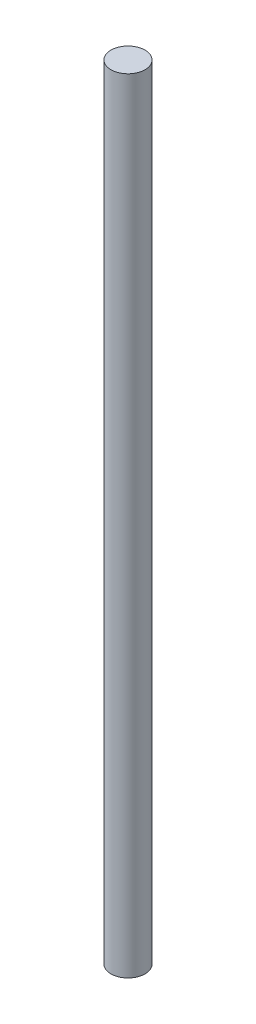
SolidWorks part; units mm, degrees
ref_plane "Front Plane" through (0, 0, 0) normal (0, 0, 1) x (1, 0, 0)
ref_plane "Top Plane" through (0, 0, 0) normal (0, 1, 0) x (1, 0, 0)
ref_plane "Right Plane" through (0, 0, 0) normal (1, 0, 0) x (0, 0, -1)
sketch "Sketch1" plane through (0, 0, 0) normal (0, 1, 0) x (1, 0, 0)
  circle A0 centre (0, 0) radius 3.175
extrude "Boss-Extrude1" add sketch "Sketch1" along normal blind 146.05
